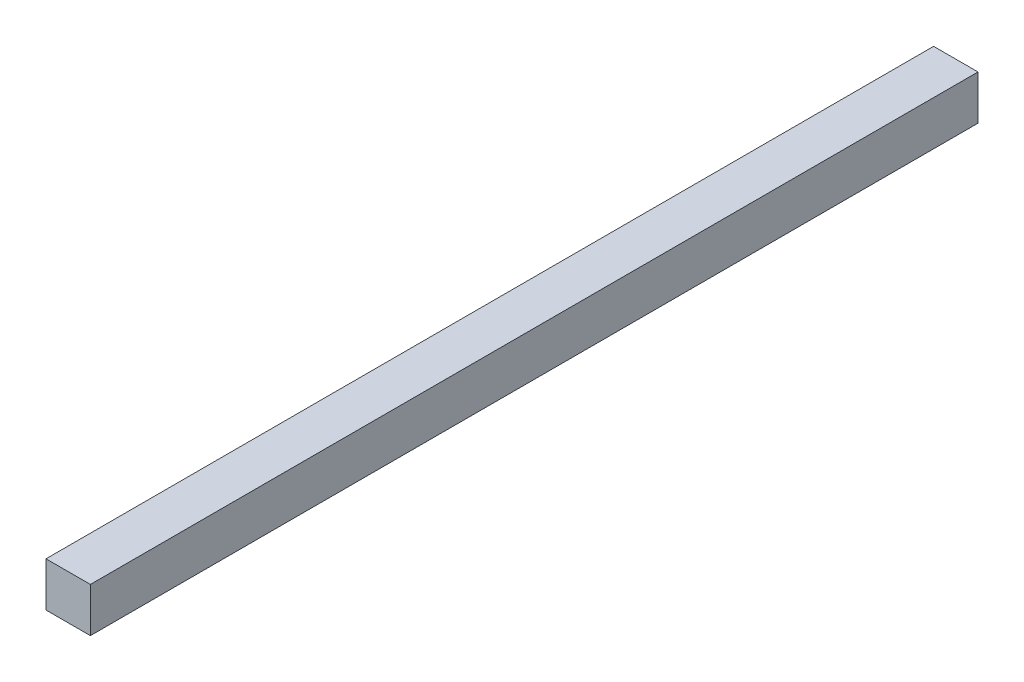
SolidWorks part; units mm, degrees
ref_plane "Alzado" through (0, 0, 0) normal (0, 0, 1) x (1, 0, 0)
ref_plane "Planta" through (0, 0, 0) normal (0, 1, 0) x (1, 0, 0)
ref_plane "Vista lateral" through (0, 0, 0) normal (1, 0, 0) x (0, 0, -1)
sketch "Croquis1" plane through (0, 0, 0) normal (0, 0, 1) x (1, 0, 0)
  line L1 (-6.35, 0) -> (6.35, 0)
  line L2 (-6.35, 0) -> (-6.35, -12.7)
  line L3 (-6.35, -12.7) -> (6.35, -12.7)
  line L4 (6.35, 0) -> (6.35, -12.7)
  point P4 (0, 0)
  dimension "D1" = 12.7
  dimension "D2" = 12.7
extrude "Saliente-Extruir1" add sketch "Croquis1" along normal mid plane 254
